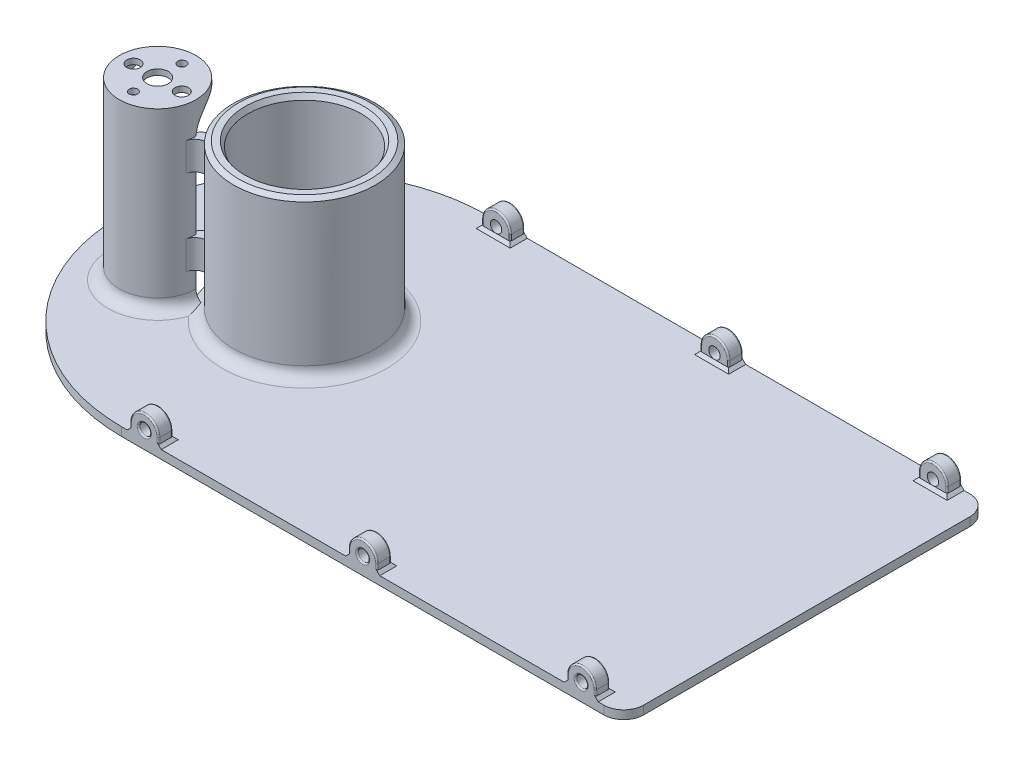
SolidWorks part; units mm, degrees
ref_plane "Front Plane" through (0, 0, 0) normal (0, 0, 1) x (1, 0, 0)
ref_plane "Top Plane" through (0, 0, 0) normal (0, 1, 0) x (1, 0, 0)
ref_plane "Right Plane" through (0, 0, 0) normal (1, 0, 0) x (0, 0, -1)
sketch "Sketch1" plane through (0, 0, 0) normal (0, 1, 0) x (1, 0, 0)
  circle A0 centre (0, 0) radius 20
  circle A1 centre (0, 0) radius 25
  dimension "D1" = 40
  dimension "D2" = 50
extrude "Boss-Extrude1" add sketch "Sketch1" along normal blind 55
chamfer "Chamfer1" distance 1 angle 60 1 edges at (0, 55, 25)
chamfer "Chamfer2" distance 1 angle 60 1 edges at (0, 55, 20)
sketch "Sketch2" plane through (0, 0, 0) normal (0, -1, 0) x (1, 0, 0)
  line L0 (0, 64.5) -> (177, 64.5)
  line L1 (0, -64.5) -> (177, -64.5)
  line L2 (177, 64.5) -> (177, -64.5)
  arc A0 (0, 64.5) -> (0, -64.5) centre (0, 0) ccw
  circle A1 centre (0, 0) radius 20
  dimension "D1" = 129
  dimension "D2" = 177
extrude "Boss-Extrude2" add sketch "Sketch2" along normal blind 3
fillet "Fillet1" radius 7 2 edges at (177, -1.5, -64.5) (177, -1.5, 64.5)
sketch "Sketch4" plane through (0, 0, 64.5) normal (0, 0, 1) x (1, 0, 0)
  line L0 (170, 0) -> (167, 0) construction
  line L1 (170, 0) -> (0, 0) construction
  line L2 (167, 0) -> (167, 3)
  line L3 (157, 0) -> (157, 3)
  line L4 (157, 0) -> (167, 0)
  line L5 (13, 0) -> (80, 0) construction
  line L6 (13, 0) -> (13, 3)
  line L7 (3, 0) -> (3, 3)
  line L8 (3, 0) -> (13, 0)
  line L9 (90, 0) -> (90, 3)
  line L10 (80, 0) -> (80, 3)
  line L11 (80, 0) -> (90, 0)
  line L13 (0, 0) -> (3, 0) construction
  line L14 (13, 0) -> (80, 0) construction
  line L15 (90, 0) -> (157, 0) construction
  arc A0 (157, 3) -> (167, 3) centre (162, 3) cw
  circle A1 centre (162, 3) radius 2
  arc A2 (3, 3) -> (13, 3) centre (8, 3) cw
  circle A3 centre (8, 3) radius 2
  arc A4 (80, 3) -> (90, 3) centre (85, 3) cw
  circle A5 centre (85, 3) radius 2
  dimension "D3" = 5
  dimension "D4" = 4
  dimension "D1" = 3
  dimension "D2" = 3
  dimension "D6" = 3
extrude "Boss-Extrude3" add sketch "Sketch4" against normal blind 5
sketch "Sketch5" plane through (0, 0, -64.5) normal (0, 0, -1) x (-1, 0, 0)
  line L0 (0, 0) -> (-3, 0) construction
  line L1 (-3, 0) -> (-3, 3)
  line L2 (-13, 0) -> (-13, 3)
  line L3 (-13, 0) -> (-3, 0)
  line L4 (0, 0) -> (-170, 0) construction
  line L5 (-157, 0) -> (-157, 3)
  line L6 (-167, 0) -> (-167, 3)
  line L7 (-167, 0) -> (-157, 0)
  line L8 (-80, 0) -> (-80, 3)
  line L9 (-90, 0) -> (-90, 3)
  line L10 (-90, 0) -> (-80, 0)
  line L11 (-170, 0) -> (-167, 0) construction
  line L12 (-157, 0) -> (-90, 0) construction
  line L13 (-80, 0) -> (-13, 0) construction
  arc A0 (-13, 3) -> (-3, 3) centre (-8, 3) cw
  circle A1 centre (-8, 3) radius 2
  arc A2 (-167, 3) -> (-157, 3) centre (-162, 3) cw
  circle A3 centre (-162, 3) radius 2
  arc A4 (-90, 3) -> (-80, 3) centre (-85, 3) cw
  circle A5 centre (-85, 3) radius 2
  dimension "D3" = 5
  dimension "D4" = 4
  dimension "D1" = 3
  dimension "D2" = 3
  dimension "D5" = 3
extrude "Boss-Extrude4" add sketch "Sketch5" against normal blind 5
chamfer "Chamfer3" distance 1 angle 45 18 edges at (157, 0, 62) (162, 0, 59.5) (167, 0, 62) (3, 0, 62) (8, 0, 59.5) (13, 0, 62) (80, 0, 62) (85, 0, 59.5) (90, 0, 62) (3, 0, -62) (8, 0, -59.5) (13, 0, -62) (90, 0, -62) (85, 0, -59.5) (80, 0, -62) (157, 0, -62) (162, 0, -59.5) (167, 0, -62)
fillet "Fillet2" radius 0.5 6 edges at (164, 3, 64.5) (10, 3, 64.5) (87, 3, 64.5) (6, 3, -64.5) (83, 3, -64.5) (160, 3, -64.5)
fillet "Fillet3" radius 0.5 36 edges at (167, 2, 59.5) (157, 2, 59.5) (167, 2, 64.5) (157, 2, 64.5) (162, 8, 59.5) (162, 8, 64.5) (13, 2, 59.5) (3, 2, 59.5) (13, 2, 64.5) (3, 2, 64.5) (90, 2, 59.5) (80, 2, 59.5) (90, 2, 64.5) (80, 2, 64.5) (8, 8, 59.5) (8, 8, 64.5) (85, 8, 59.5) (85, 8, 64.5) (3, 2, -59.5) (13, 2, -59.5) (3, 2, -64.5) (13, 2, -64.5) (80, 2, -59.5) (90, 2, -59.5) (80, 2, -64.5) (90, 2, -64.5) (157, 2, -59.5) (167, 2, -59.5) (157, 2, -64.5) (167, 2, -64.5) (8, 8, -59.5) (8, 8, -64.5) (85, 8, -59.5) (85, 8, -64.5) (162, 8, -59.5) (162, 8, -64.5)
sketch "Sketch6" plane through (0, 0, 0) normal (0, 1, 0) x (1, 0, 0)
  line L0 (0, 0) -> (-38.4563, -13.3269) construction
  line L1 (-24.2733, -13.3269) -> (-53.4365, -13.3269) construction
  line L2 (-51.9563, -13.3269) -> (-50.7063, -13.3269)
  line L3 (-26.2063, -13.3269) -> (-24.9563, -13.3269)
  circle A2 centre (0, 0) radius 22.5 construction
  arc A4 (-50.7063, -13.3269) -> (-26.2063, -13.3269) centre (-38.4563, -13.3269) ccw
  arc A5 (-51.9563, -13.3269) -> (-24.9563, -13.3269) centre (-38.4563, -13.3269) ccw
  dimension "D1" = 40.7
  dimension "D2" = 24.5
  dimension "D3" = 27
extrude "Boss-Extrude5" add sketch "Sketch6" along normal blind 40
sketch "Croquis1" plane through (0, 40, 0) normal (0, 1, 0) x (1, 0, 0)
  line L0 (-51.9563, -13.3269) -> (-50.7063, -13.3269)
  line L1 (-26.2063, -13.3269) -> (-24.9563, -13.3269)
  arc A0 (-50.7063, -13.3269) -> (-26.2063, -13.3269) centre (-38.4563, -13.3269) ccw
  arc A1 (-51.9563, -13.3269) -> (-24.9563, -13.3269) centre (-38.4563, -13.3269) ccw construction
  arc A2 (-24.9563, -13.3269) -> (-51.9563, -13.3269) centre (-38.4563, -13.3269) cw
extrude "Saliente-Extruir2" add sketch "Croquis1" along normal blind 19.75
sketch "Croquis2" plane through (0, 59.75, 0) normal (0, 1, 0) x (1, 0, 0)
  circle A0 centre (-38.4563, -13.3269) radius 13.5
  arc A1 (-51.9563, -13.3269) -> (-24.9563, -13.3269) centre (-38.4563, -13.3269) ccw construction
  dimension "D1" = 27
extrude "Saliente-Extruir3" add sketch "Croquis2" along normal blind 2
sketch "Croquis3" plane through (0, 61.75, 0) normal (0, 1, 0) x (1, 0, 0)
  circle A0 centre (-38.4563, -4.7769) radius 1.5
  circle A1 centre (-38.4563, -21.8769) radius 1.5
  circle A2 centre (-46.9563, -13.3269) radius 2.375
  circle A3 centre (-29.9563, -13.3269) radius 2.375
  circle A4 centre (-38.4563, -13.3269) radius 3.75
  circle A5 centre (-38.4563, -13.3269) radius 13.5 construction
  dimension "D1" = 4.75
  dimension "D2" = 3
  dimension "D3" = 7.5
  dimension "D4" = 8.55
  dimension "D5" = 8.5
  dimension "D6" = 8.5
  dimension "D7" = 8.55
extrude "Cortar-Extruir1" cut sketch "Croquis3" against normal blind 2
fillet "Redondeo1" radius 4 2 edges at (-38.4563, 0, 26.8269) (0, 0, 25)
sketch "Croquis4" plane through (0, 0, 13.3269) normal (0, 0, -1) x (-1, 0, 0)
  line L0 (24.9563, 59.75) -> (24.9563, 4) construction
  line L1 (24.9563, 50.6218) -> (26.2063, 50.6218)
  line L2 (24.9563, 50.6218) -> (24.9563, 40.6218)
  line L3 (24.9563, 40.6218) -> (26.2063, 40.6218)
  line L4 (26.2063, 50.6218) -> (26.2063, 40.6218)
  line L5 (26.2063, 59.75) -> (26.2063, 0) construction
  line L7 (24.9563, 20.6218) -> (26.2063, 20.6218)
  line L8 (24.9563, 20.6218) -> (24.9563, 10.6218)
  line L9 (24.9563, 10.6218) -> (26.2063, 10.6218)
  line L10 (26.2063, 20.6218) -> (26.2063, 10.6218)
  dimension "D1" = 10
  dimension "D2" = 10
  dimension "D3" = 20
extrude "Saliente-Extruir4" add sketch "Croquis4" along normal blind 3
sketch "Croquis5" plane through (-24.9563, 0, 0) normal (1, 0, 0) x (0, 0, -1)
  line L1 (-13.3269, 50.6218) -> (-10.3269, 50.6218)
  line L2 (-13.3269, 50.6218) -> (-13.3269, 40.6218)
  line L3 (-13.3269, 40.6218) -> (-10.3269, 40.6218)
  line L4 (-10.3269, 50.6218) -> (-10.3269, 40.6218)
  line L5 (-13.3269, 20.6218) -> (-10.3269, 20.6218)
  line L6 (-13.3269, 20.6218) -> (-13.3269, 10.6218)
  line L7 (-13.3269, 10.6218) -> (-10.3269, 10.6218)
  line L8 (-10.3269, 20.6218) -> (-10.3269, 10.6218)
extrude "Saliente-Extruir5" add sketch "Croquis5" along normal up to surface (2.1888 mm away)
fillet "Redondeo3" radius 4 2 edges at (-24.9563, 15.6218, 13.3269) (-24.9563, 45.6218, 13.3269)
fillet "Redondeo4" radius 3 2 edges at (-26.2063, 15.6218, 10.3269) (-26.2063, 45.6218, 10.3269)
fillet "Redondeo5" radius 10 2 edges at (-25.5813, 59.75, 13.3269) (-51.3313, 59.75, 13.3269)
sketch "Croquis6" plane through (0, 0, 0) normal (0, 1, 0) x (1, 0, 0)
  circle A0 centre (-38.4563, -13.3269) radius 12.25
extrude "Cortar-Extruir2" cut sketch "Croquis6" against normal blind 10
sketch "Croquis7" plane through (0, 0, 0) normal (0, 1, 0) x (1, 0, 0)
  line L1 (-30.9786, -3.624) -> (-45.9123, -3.624)
  line L2 (-30.9786, -3.624) -> (-30.9786, 5.0181)
  line L3 (-30.9786, 5.0181) -> (-45.9123, 5.0181)
  line L4 (-45.9123, -3.624) -> (-45.9123, 5.0181)
  arc A0 (-28.2501, -6.5521) -> (-50.7063, -13.3269) centre (-38.4563, -13.3269) ccw construction
extrude "Cortar-Extruir3" cut sketch "Croquis7" against normal blind 10
